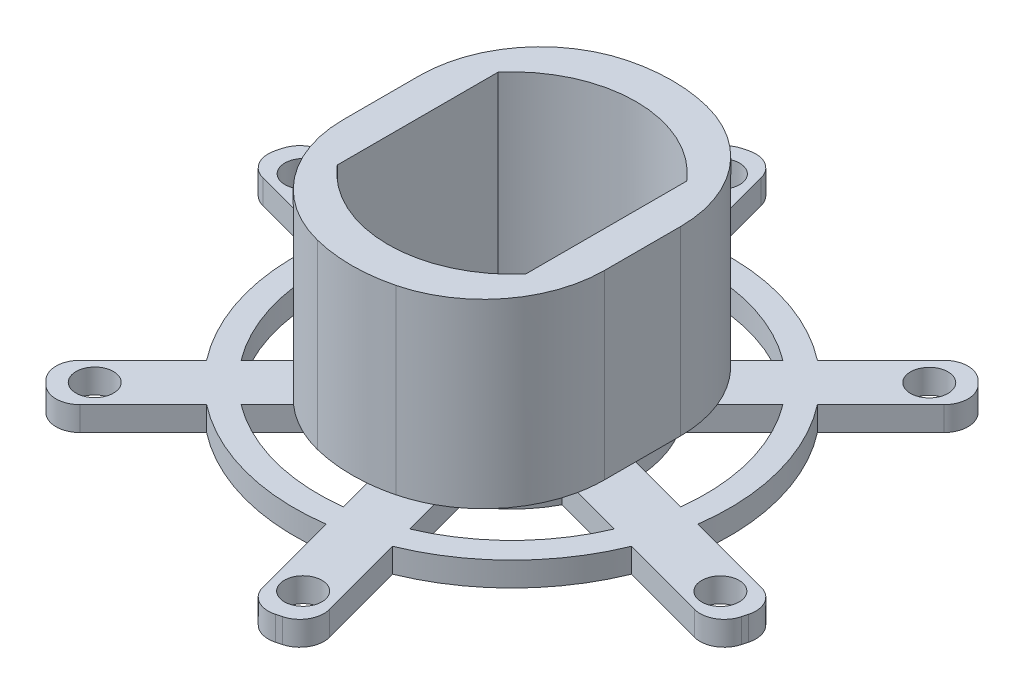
SolidWorks part; units mm, degrees
ref_plane "Front Plane" through (0, 0, 0) normal (0, 0, 1) x (1, 0, 0)
ref_plane "Top Plane" through (0, 0, 0) normal (0, 1, 0) x (1, 0, 0)
ref_plane "Right Plane" through (0, 0, 0) normal (1, 0, 0) x (0, 0, -1)
sketch "Sketch2" plane through (0, 0, 0) normal (0, 1, 0) x (1, 0, 0)
  circle A0 centre (0, 0) radius 18
  circle A1 centre (0, 0) radius 16
  circle A2 centre (0, 0) radius 8
  circle A3 centre (0, 0) radius 10
  dimension "D1" = 36
  dimension "D3" = 2
  dimension "D2" = 2
extrude "Boss-Extrude1" add sketch "Sketch2" against normal blind 2 contours A0 A1 | A3 A2
sketch "Sketch3" plane through (0, 0, 0) normal (0, 1, 0) x (1, 0, 0)
  line L0 (0.0182, -0.0045) -> (15.4611, 15.4384) construction
  line L1 (-0.1123, -0.066) -> (20.4155, -20.5938) construction
  line L2 (3.182, 0) -> (20.8597, 17.6777)
  line L3 (-1.1, 0) -> (1.1, 0) construction
  line L4 (20.8597, 17.6777) -> (17.6777, 20.8597)
  line L5 (17.6777, 20.8597) -> (0, 3.182)
  line L6 (0, -1.1) -> (0, 1.1) construction
  line L7 (0, 3.182) -> (3.182, 0)
  circle A0 centre (17.2648, 17.2421) radius 1.55
  circle A1 centre (0, 0) radius 24.4 construction
  dimension "D2" = 25
  dimension "D4" = 3.1
  dimension "D5" = 48.8
  dimension "D1" = 45
  dimension "D3" = 4.5
extrude "Boss-Extrude2" add sketch "Sketch3" against normal blind 2
fillet "Fillet1" radius 2 2 edges at (17.6777, -1, -20.8597) (20.8597, -1, -17.6777)
pattern_circular "CirPattern1" count 6 over 360 about axis through (0, 0, 0) along (0, 1, 0) of "Fillet1", "Boss-Extrude2"
sketch "Sketch1" plane through (0, 0, 0) normal (0, 1, 0) x (1, 0, 0)
  line L0 (-7.8, 6.65) -> (-7.8, -6.65)
  line L1 (7.8, -6.65) -> (7.8, 6.65)
  line L2 (0, -1.1) -> (0, 1.1) construction
  line L4 (-10.8, 7.6761) -> (-10.8, -7.6761)
  line L5 (10.8, -7.6761) -> (10.8, 7.6761)
  arc A0 (-7.8, -6.65) -> (7.8, -6.65) centre (0, 0) ccw
  arc A1 (7.8, 6.65) -> (-7.8, 6.65) centre (0, 0) ccw
  arc A2 (-10.8, -7.6761) -> (10.8, -7.6761) centre (0, 0) ccw
  arc A3 (10.8, 7.6761) -> (-10.8, 7.6761) centre (0, 0) ccw
  dimension "D1" = 15.6
  dimension "D4" = 10.25
  dimension "D2" = 7.8
  dimension "D3" = 3
extrude "Boss-Extrude3" add sketch "Sketch1" along normal blind 15
fillet "Fillet2" radius 10 4 edges at (-10.8, 7.5, 7.6761) (-10.8, 7.5, -7.6761) (10.8, 7.5, -7.6761) (10.8, 7.5, 7.6761)
